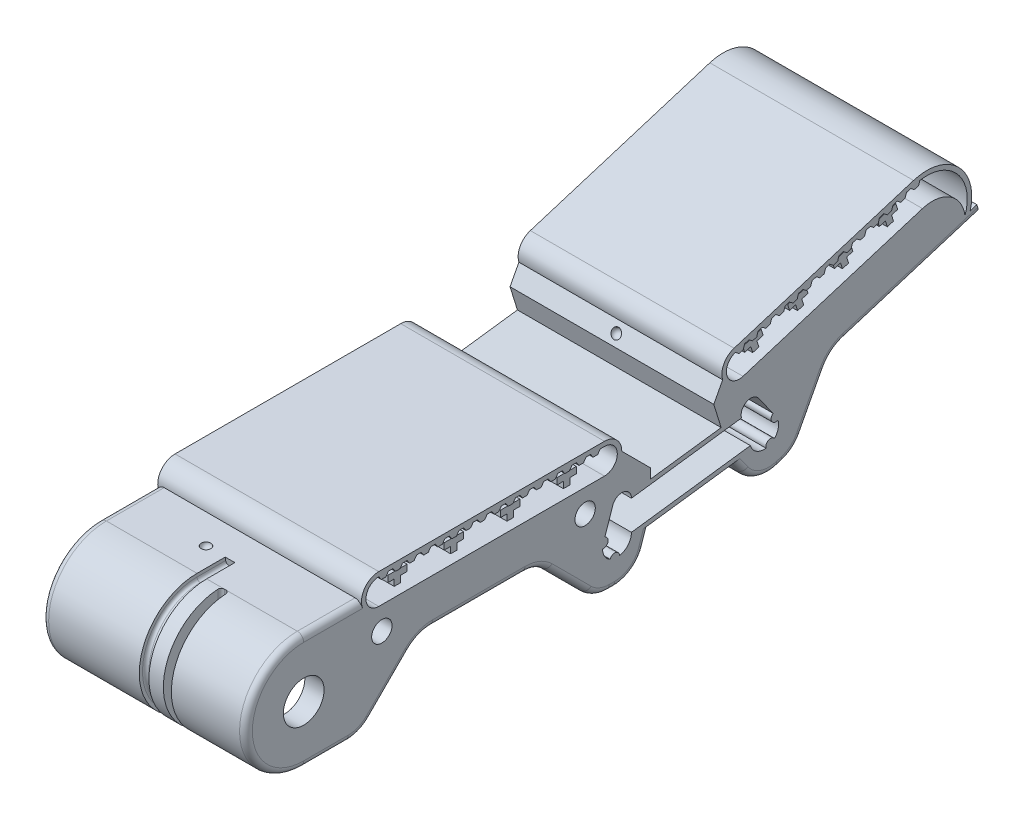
SolidWorks part; units mm, degrees
ref_plane "Front Plane" through (0, 0, 0) normal (0, 0, 1) x (1, 0, 0)
ref_plane "Top Plane" through (0, 0, 0) normal (0, 1, 0) x (1, 0, 0)
ref_plane "Right Plane" through (0, 0, 0) normal (1, 0, 0) x (0, 0, -1)
sketch "Sketch1" plane through (0, 0, 0) normal (1, 0, 0) x (0, 0, -1)
  line L0 (0, 0) -> (54.0462, 0) construction
  line L1 (54.0462, 0) -> (65.9436, 1.5663) construction
  line L2 (65.9436, 1.5663) -> (98.4935, 11.6394) construction
  line L3 (0, 0) -> (59.9949, 0.7832) construction
  line L4 (59.9949, 0.7832) -> (98.4935, 11.6394) construction
  line L5 (0, 3.175) -> (0, -3.175) construction
  line L6 (0, 9) -> (54.0462, 9)
  line L7 (0, -9) -> (54.0462, -9)
  line L8 (54.0462, 9) -> (54.0462, -9) construction
  line L9 (63.2829, 10.164) -> (95.8328, 20.2371)
  line L10 (68.6042, -7.0314) -> (101.1542, 3.0416)
  line L11 (101.1542, 3.0416) -> (95.8328, 20.2371)
  line L12 (63.2829, 10.164) -> (68.6042, -7.0314) construction
  line L13 (54.0462, 9) -> (54.0462, 3.0058)
  line L14 (54.0462, 3.0058) -> (65.0498, 4.4545)
  line L15 (65.0498, 4.4545) -> (63.2829, 10.164)
  line L16 (54.0462, -9) -> (54.0462, -3.0058)
  line L17 (54.0462, -3.0058) -> (66.8373, -1.3218)
  line L18 (66.8373, -1.3218) -> (68.6042, -7.0314)
  line L19 (54.0462, 9) -> (63.2829, 10.164) construction
  line L20 (54.0462, -9) -> (68.6042, -7.0314) construction
  circle A0 centre (0, 0) radius 3.175
  arc A1 (0, 9) -> (0, -9) centre (0, 0) ccw
  dimension "D6" = 6.35
  dimension "D7" = 18
  dimension "D1" = 15
  dimension "D2" = 7.5
  dimension "D3" = 60
  dimension "D4" = 40
  dimension "D5" = 12
  dimension "D8" = 18
  dimension "D9" = 5.9602
extrude "Base" add sketch "Sketch1" along normal mid plane 31.75
sketch "Sketch2" plane through (15.875, 0, 0) normal (1, 0, 0) x (0, 0, -1)
  line L0 (59.548, 3.7301) -> (60.4418, -2.1638) construction
  line L1 (65.0498, 4.4545) -> (54.0462, 3.0058) construction
  line L2 (54.0462, -3.0058) -> (66.8373, -1.3218) construction
  line L3 (54.0462, 3.0058) -> (54.0462, -3.0058) construction
  line L4 (65.0498, 4.4545) -> (66.8373, -1.3218) construction
  line L5 (54.0462, 0) -> (65.9436, 1.5663) construction
  line L6 (54.0462, 2.2998) -> (65.2597, 3.7761)
  line L7 (54.0462, -2.2998) -> (66.6274, -0.6434)
  line L8 (54.0462, 2.2998) -> (51.0719, 1.9082)
  line L9 (54.0462, -2.2998) -> (51.0719, -2.6914)
  line L10 (48.1496, 2.3847) -> (46.6884, -1.9766)
  line L11 (51.0719, 1.9082) -> (51.0719, -2.6914) construction
  line L12 (65.2597, 3.7761) -> (68.2341, 4.1676)
  line L13 (66.6274, -0.6434) -> (69.6017, -0.2519)
  line L14 (70.8865, 5.4845) -> (73.5804, 1.7235)
  line L15 (68.2341, 4.1676) -> (69.6017, -0.2519) construction
  arc A0 (51.0719, 1.9082) -> (48.1496, 2.3847) centre (49.5719, 1.9082) ccw
  arc A1 (51.0719, -2.6914) -> (46.6884, -1.9766) centre (48.8219, -2.6914) cw
  arc A2 (68.2341, 4.1676) -> (70.8865, 5.4845) centre (69.667, 4.6111) cw
  arc A3 (69.6017, -0.2519) -> (73.5804, 1.7235) centre (71.7512, 0.4133) ccw
  point P14 (59.9949, 0.7832)
  dimension "D3" = 1.5
  dimension "D4" = 2.25
  dimension "D1" = 0.7
  dimension "D2" = 3
extrude "Flexure" cut sketch "Sketch2" against normal through all
sketch "Sketch3" plane through (15.875, 0, 0) normal (1, 0, 0) x (0, 0, -1)
  line L0 (46.6884, -1.9766) -> (51.0719, -2.6914) construction
  line L1 (69.6017, -0.2519) -> (73.5804, 1.7235) construction
  line L2 (48.8802, -2.334) -> (48.4598, -4.912) construction
  line L3 (71.591, 0.7358) -> (72.7517, -1.602) construction
  arc A0 (46.6884, -1.9766) -> (51.0719, -2.6914) centre (48.8219, -2.6914) ccw construction
  arc A1 (69.6017, -0.2519) -> (73.5804, 1.7235) centre (71.7512, 0.4133) ccw construction
  circle A2 centre (46.6884, -1.9766) radius 0.75
  circle A3 centre (48.4598, -4.912) radius 0.75
  circle A4 centre (72.7517, -1.602) radius 0.75
  circle A5 centre (73.5804, 1.7235) radius 0.75
  dimension "D1" = 1.5
extrude "Flexure Anchors" add sketch "Sketch3" against normal up to surface (31.75 mm away)
sketch "Sketch4" plane through (15.875, 0, 0) normal (1, 0, 0) x (0, 0, -1)
  line L0 (27.0231, -9) -> (27.0231, 9) construction
  line L1 (0, -9) -> (54.0462, -9) construction
  line L2 (54.0462, 9) -> (0, 9) construction
  line L3 (-8.3297, 3.4082) -> (54.0462, 3.4082) construction
  line L4 (54.0462, 3.0058) -> (54.0462, 9) construction
  line L5 (48.1496, 2.3847) -> (46.9267, -1.2655) construction
  line L6 (44.9746, 2.2857) -> (51.689, 9) construction
  line L7 (49.5676, 9) -> (54.0462, 4.5214)
  line L8 (54.0462, 4.5214) -> (54.0462, 9)
  line L9 (54.0462, 9) -> (49.5676, 9)
  line L10 (63.2829, 10.164) -> (63.902, 8.1634)
  line L11 (63.2829, 10.164) -> (65.0498, 4.4545) construction
  line L12 (63.902, 8.1634) -> (65.2835, 10.7831)
  line L13 (95.8328, 20.2371) -> (63.2829, 10.164) construction
  line L14 (65.2835, 10.7831) -> (63.2829, 10.164)
  line L15 (59.653, 3.0379) -> (60.3368, -1.4716) construction
  line L16 (68.2341, 4.1676) -> (51.0719, 1.9082) construction
  line L17 (51.0719, -2.6914) -> (69.6017, -0.2519) construction
  line L18 (59.9949, 0.7832) -> (73.0252, 2.4986) construction
  line L19 (73.1436, 2.3332) -> (70.8865, 5.4845) construction
  arc A0 (0, 9) -> (0, -9) centre (0, 0) ccw construction
  arc A1 (51.0719, 1.9082) -> (48.1496, 2.3847) centre (49.5719, 1.9082) ccw construction
  circle A2 centre (43.8521, 3.4082) radius 1.5875
  circle A3 centre (12.175, 3.4082) radius 1.5875
  circle A6 centre (0, 0) radius 3.175 construction
  point P38 (64.5838, 9.4563)
  dimension "D1" = 3.175
  dimension "D2" = 4.4
  dimension "D5" = 12.175
  dimension "D3" = 45
  dimension "D4" = 1.5
  dimension "D6" = 1.5
  dimension "D7" = 8
extrude "Pin Holes" cut sketch "Sketch4" against normal through all
sketch "Sketch5" plane through (0, 29.2838, -29.2838) normal (0, 0.7071, -0.7071) x (1, 0, 0)
  line L0 (0, 28.6857) -> (0, 35.0193) construction
  line L1 (-15.875, 28.6857) -> (15.875, 28.6857) construction
  line L2 (-15.875, 35.0193) -> (15.875, 35.0193) construction
  circle A0 centre (0, 30.1857) radius 0.75
  dimension "D1" = 1.5
  dimension "D2" = 1.5
extrude "Tendon Route 1" cut sketch "Sketch5" against normal blind 0.75
sketch "Sketch6" plane through (0, -24.5899, -46.6298) normal (0, 0.4665, 0.8845) x (1, 0, 0)
  line L0 (0, 39.9901) -> (0, 37.0285) construction
  line L1 (-15.875, 39.9901) -> (15.875, 39.9901) construction
  line L2 (-15.875, 37.0285) -> (15.875, 37.0285) construction
  circle A0 centre (0, 38.4901) radius 0.75
  dimension "D1" = 1.5
  dimension "D2" = 1.5
extrude "Tendon Route 2" cut sketch "Sketch6" against normal blind 0.75
sketch "Sketch10" plane through (15.875, 0, 0) normal (1, 0, 0) x (0, 0, -1)
  line L0 (11.7, 11.7) -> (46.8676, 11.7)
  line L1 (49.5676, 9) -> (0, 9) construction
  line L2 (9, 9) -> (49.5676, 9)
  line L3 (65.2835, 10.7831) -> (95.8328, 20.2371)
  line L4 (67.0646, 14.1607) -> (95.0346, 22.8164)
  line L5 (95.8328, 20.2371) -> (95.0346, 22.8164) construction
  line L6 (101.1542, 3.0416) -> (95.8328, 20.2371) construction
  line L7 (95.8328, 20.2371) -> (99.1735, 9.4422)
  arc A0 (46.8676, 11.7) -> (49.5676, 9) centre (46.8676, 9) cw
  arc A1 (11.7, 11.7) -> (9, 9) centre (11.7, 9) ccw
  arc A2 (65.2835, 10.7831) -> (67.0646, 14.1607) centre (67.8628, 11.5813) cw
  arc A3 (95.0346, 22.8164) -> (99.1735, 9.4422) centre (97.104, 16.1293) cw
  dimension "D3" = 7
  dimension "D1" = 2.7
  dimension "D2" = 9
extrude "Finger Pad Outline" add sketch "Sketch10" against normal up to surface (31.75 mm away)
sketch "Sketch11" plane through (15.875, 0, 0) normal (1, 0, 0) x (0, 0, -1)
  line L0 (82.3108, 6.1025) -> (103.114, 12.5404)
  line L1 (68.6042, -7.0314) -> (101.1542, 3.0416) construction
  line L2 (76.7071, -4.5239) -> (107.8413, 5.1111)
  line L3 (107.8413, 5.1111) -> (103.7911, 18.1987)
  line L4 (68.2341, 4.1676) -> (69.6017, -0.2519) construction
  line L5 (68.9179, 1.9579) -> (103.114, 12.5404) construction
  line L6 (82.3108, 6.1025) -> (76.7071, -4.5239)
  line L7 (63.902, 8.1634) -> (65.2835, 10.7831) construction
  line L8 (66.8373, -1.3218) -> (68.6042, -7.0314)
  line L9 (68.6042, -7.0314) -> (70.5054, -6.4431)
  line L10 (70.5054, -6.4431) -> (66.8373, -1.3218)
  line L11 (73.1436, 2.3332) -> (70.8865, 5.4845) construction
  line L12 (70.5054, -6.4431) -> (76.7071, -4.5239) construction
  line L13 (54.0462, -3.0058) -> (52.038, -9)
  line L14 (0, -9) -> (54.0462, -9) construction
  line L15 (52.038, -9) -> (54.0462, -9)
  line L16 (54.0462, -9) -> (54.0462, -3.0058)
  line L17 (48.1496, 2.3847) -> (46.9267, -1.2655) construction
  line L18 (9, 9) -> (9, -9) construction
  line L19 (0, 0) -> (47.3506, 0) construction
  line L20 (9, -9) -> (18, 0)
  line L21 (18, 0) -> (36.5462, 0)
  line L22 (36.5462, 0) -> (45.5462, -9)
  line L23 (45.5462, -9) -> (52.038, -9)
  line L24 (49.5676, 9) -> (54.0462, 4.5214) construction
  line L25 (51.0719, 1.9082) -> (51.0719, -2.6914) construction
  line L26 (9, -9) -> (45.5462, -9)
  arc A0 (99.1735, 9.4422) -> (95.0346, 22.8164) centre (97.104, 16.1293) ccw construction
  arc A1 (103.114, 12.5404) -> (103.7911, 18.1987) centre (97.104, 16.1293) ccw
  dimension "D1" = 8.5
extrude "Finger Outline" cut sketch "Sketch11" against normal through all
sketch "Sketch12" plane through (15.875, 0, 0) normal (1, 0, 0) x (0, 0, -1)
  line L0 (9, 9) -> (49.5676, 9) construction
  line L1 (65.2835, 10.7831) -> (101.1095, 21.87) construction
  line L2 (95.0346, 22.8164) -> (67.0646, 14.1607) construction
  line L3 (11.7, 11.7) -> (11.7, 6.3) construction
  line L4 (11.7, 11) -> (46.8676, 11)
  line L5 (46.8676, 11.7) -> (46.8676, 6.3) construction
  line L6 (46.8676, 11.7) -> (11.7, 11.7) construction
  line L7 (11.7, 7) -> (46.8676, 7)
  line L8 (67.0646, 14.1607) -> (68.8973, 8.2385) construction
  line L9 (67.2715, 13.492) -> (95.2416, 22.1477)
  line L10 (68.454, 9.6707) -> (96.4241, 18.3265)
  line L11 (95.0346, 22.8164) -> (97.7804, 13.9436) construction
  arc A0 (103.114, 12.5404) -> (95.0346, 22.8164) centre (97.104, 16.1293) ccw construction
  arc A1 (11.7, 11) -> (11.7, 7) centre (11.7, 9) ccw
  arc A2 (46.8676, 11) -> (46.8676, 7) centre (46.8676, 9) cw
  arc A3 (67.2715, 13.492) -> (68.454, 9.6707) centre (67.8628, 11.5813) ccw
  arc A4 (95.2416, 22.1477) -> (103.0476, 14.0404) centre (97.104, 16.1293) cw
  arc A5 (96.4241, 18.3265) -> (103.0476, 14.0404) centre (97.9441, 13.4146) cw
  dimension "D1" = 0.7
  dimension "D2" = 0.7
  dimension "D3" = 1.5
extrude "Finger Pad Cavity" cut sketch "Sketch12" against normal through all
sketch "Sketch15" plane through (0, 0, 0) normal (1, 0, 0) x (0, 0, -1)
  line L0 (11.7, 7) -> (46.8676, 7) construction
  line L1 (11.7, 7) -> (46.8676, 7) construction
  line L2 (46.8676, 11) -> (11.7, 11) construction
  line L3 (46.8676, 11) -> (11.7, 11) construction
  line L4 (29.2838, 11) -> (29.2838, 7) construction
  line L5 (11.7, 8) -> (20.4919, 8) construction
  line L6 (16.096, 7) -> (16.096, 8) construction
  line L7 (11.7, 11) -> (11.7, 7) construction
  line L8 (25.3879, 8) -> (25.3879, 7)
  line L9 (26.3879, 8) -> (25.3879, 8)
  line L10 (11.7, 9) -> (29.2838, 9) construction
  line L11 (20.4919, 9) -> (20.4919, 7) construction
  line L12 (15.596, 7) -> (16.596, 7)
  line L13 (16.596, 7) -> (16.596, 8)
  line L14 (16.596, 8) -> (17.596, 8)
  line L15 (17.596, 8) -> (17.596, 9)
  line L16 (17.596, 9) -> (14.596, 9)
  line L17 (14.596, 9) -> (14.596, 8)
  line L18 (14.596, 8) -> (15.596, 8)
  line L19 (15.596, 8) -> (15.596, 7)
  line L20 (26.3879, 9) -> (26.3879, 8)
  line L21 (23.3879, 9) -> (26.3879, 9)
  line L22 (23.3879, 8) -> (23.3879, 9)
  line L23 (24.3879, 8) -> (23.3879, 8)
  line L24 (24.3879, 7) -> (24.3879, 8)
  line L25 (25.3879, 7) -> (24.3879, 7)
  line L26 (33.1798, 7) -> (34.1798, 7)
  line L27 (34.1798, 7) -> (34.1798, 8)
  line L28 (34.1798, 8) -> (35.1798, 8)
  line L29 (35.1798, 8) -> (35.1798, 9)
  line L30 (35.1798, 9) -> (32.1798, 9)
  line L31 (32.1798, 9) -> (32.1798, 8)
  line L32 (32.1798, 8) -> (33.1798, 8)
  line L33 (33.1798, 8) -> (33.1798, 7)
  line L34 (42.9717, 8) -> (42.9717, 7)
  line L35 (43.9717, 8) -> (42.9717, 8)
  line L36 (43.9717, 9) -> (43.9717, 8)
  line L37 (40.9717, 9) -> (43.9717, 9)
  line L38 (40.9717, 8) -> (40.9717, 9)
  line L39 (41.9717, 8) -> (40.9717, 8)
  line L40 (41.9717, 7) -> (41.9717, 8)
  line L41 (42.9717, 7) -> (41.9717, 7)
  line L42 (68.454, 9.6707) -> (96.4241, 18.3265) construction
  line L43 (95.2416, 22.1477) -> (67.2715, 13.492) construction
  line L44 (68.454, 9.6707) -> (96.4241, 18.3265) construction
  line L45 (95.2416, 22.1477) -> (67.2715, 13.492) construction
  line L46 (67.2715, 13.492) -> (68.454, 9.6707) construction
  line L47 (81.2565, 17.8198) -> (82.4391, 13.9986) construction
  line L48 (67.8628, 11.5813) -> (81.8478, 15.9092) construction
  line L49 (74.8553, 13.7453) -> (75.4466, 11.8347) construction
  line L50 (69.9261, 12.2199) -> (70.2217, 11.2646)
  line L51 (70.2217, 11.2646) -> (71.177, 11.5602)
  line L52 (71.177, 11.5602) -> (71.4726, 10.6049)
  line L53 (71.4726, 10.6049) -> (72.4279, 10.9005)
  line L54 (72.4279, 10.9005) -> (72.1323, 11.8558)
  line L55 (72.1323, 11.8558) -> (73.0876, 12.1515)
  line L56 (73.0876, 12.1515) -> (72.792, 13.1068)
  line L57 (72.792, 13.1068) -> (69.9261, 12.2199)
  line L58 (68.1584, 10.626) -> (75.1509, 12.79) construction
  line L59 (71.9503, 10.7527) -> (71.6547, 11.708) construction
  line L60 (76.9186, 14.3838) -> (79.7845, 15.2707)
  line L61 (77.2142, 13.4285) -> (76.9186, 14.3838)
  line L62 (78.1695, 13.7241) -> (77.2142, 13.4285)
  line L63 (78.4652, 12.7688) -> (78.1695, 13.7241)
  line L64 (79.4205, 13.0645) -> (78.4652, 12.7688)
  line L65 (79.1248, 14.0198) -> (79.4205, 13.0645)
  line L66 (80.0801, 14.3154) -> (79.1248, 14.0198)
  line L67 (79.7845, 15.2707) -> (80.0801, 14.3154)
  line L68 (90.9036, 18.7117) -> (93.7695, 19.5986)
  line L69 (91.1992, 17.7564) -> (90.9036, 18.7117)
  line L70 (92.1545, 18.052) -> (91.1992, 17.7564)
  line L71 (92.4502, 17.0967) -> (92.1545, 18.052)
  line L72 (93.4055, 17.3923) -> (92.4502, 17.0967)
  line L73 (93.1098, 18.3476) -> (93.4055, 17.3923)
  line L74 (94.0651, 18.6432) -> (93.1098, 18.3476)
  line L75 (93.7695, 19.5986) -> (94.0651, 18.6432)
  line L76 (83.9111, 16.5477) -> (84.2067, 15.5924)
  line L77 (84.2067, 15.5924) -> (85.162, 15.8881)
  line L78 (85.162, 15.8881) -> (85.4577, 14.9328)
  line L79 (85.4577, 14.9328) -> (86.413, 15.2284)
  line L80 (86.413, 15.2284) -> (86.1173, 16.1837)
  line L81 (86.1173, 16.1837) -> (87.0726, 16.4793)
  line L82 (87.0726, 16.4793) -> (86.777, 17.4346)
  line L83 (86.777, 17.4346) -> (83.9111, 16.5477)
extrude "Finger Pad Hooks" add sketch "Sketch15" along normal mid plane 28.75
sketch "Sketch16" plane through (15.875, 0, 0) normal (1, 0, 0) x (0, 0, -1)
  line L0 (11.7, 11.7) -> (11.7, 11) construction
  line L1 (11.7, 11) -> (12.1, 10.4255)
  line L2 (12.1, 10.4255) -> (12.8, 10.4255)
  line L3 (12.8, 10.4255) -> (13.2, 11)
  line L4 (46.8676, 11) -> (11.7, 11) construction
  line L5 (13.2, 11) -> (11.7, 11)
  line L6 (13.9, 11) -> (14.3, 10.4255)
  line L7 (14.3, 10.4255) -> (15, 10.4255)
  line L8 (15, 10.4255) -> (15.4, 11)
  line L9 (15.4, 11) -> (13.9, 11)
  line L10 (16.1, 11) -> (16.5, 10.4255)
  line L11 (16.5, 10.4255) -> (17.2, 10.4255)
  line L12 (17.2, 10.4255) -> (17.6, 11)
  line L13 (17.6, 11) -> (16.1, 11)
  line L14 (18.3, 11) -> (18.7, 10.4255)
  line L15 (18.7, 10.4255) -> (19.4, 10.4255)
  line L16 (19.4, 10.4255) -> (19.8, 11)
  line L17 (19.8, 11) -> (18.3, 11)
  line L18 (20.5, 11) -> (20.9, 10.4255)
  line L19 (20.9, 10.4255) -> (21.6, 10.4255)
  line L20 (21.6, 10.4255) -> (22, 11)
  line L21 (22, 11) -> (20.5, 11)
  line L22 (22.7, 11) -> (23.1, 10.4255)
  line L23 (23.1, 10.4255) -> (23.8, 10.4255)
  line L24 (23.8, 10.4255) -> (24.2, 11)
  line L25 (24.2, 11) -> (22.7, 11)
  line L26 (24.9, 11) -> (25.3, 10.4255)
  line L27 (25.3, 10.4255) -> (26, 10.4255)
  line L28 (26, 10.4255) -> (26.4, 11)
  line L29 (26.4, 11) -> (24.9, 11)
  line L30 (27.1, 11) -> (27.5, 10.4255)
  line L31 (27.5, 10.4255) -> (28.2, 10.4255)
  line L32 (28.2, 10.4255) -> (28.6, 11)
  line L33 (28.6, 11) -> (27.1, 11)
  line L34 (29.3, 11) -> (29.7, 10.4255)
  line L35 (29.7, 10.4255) -> (30.4, 10.4255)
  line L36 (30.4, 10.4255) -> (30.8, 11)
  line L37 (30.8, 11) -> (29.3, 11)
  line L38 (31.5, 11) -> (31.9, 10.4255)
  line L39 (31.9, 10.4255) -> (32.6, 10.4255)
  line L40 (32.6, 10.4255) -> (33, 11)
  line L41 (33, 11) -> (31.5, 11)
  line L42 (33.7, 11) -> (34.1, 10.4255)
  line L43 (34.1, 10.4255) -> (34.8, 10.4255)
  line L44 (34.8, 10.4255) -> (35.2, 11)
  line L45 (35.2, 11) -> (33.7, 11)
  line L46 (35.9, 11) -> (36.3, 10.4255)
  line L47 (36.3, 10.4255) -> (37, 10.4255)
  line L48 (37, 10.4255) -> (37.4, 11)
  line L49 (37.4, 11) -> (35.9, 11)
  line L50 (38.1, 11) -> (38.5, 10.4255)
  line L51 (38.5, 10.4255) -> (39.2, 10.4255)
  line L52 (39.2, 10.4255) -> (39.6, 11)
  line L53 (39.6, 11) -> (38.1, 11)
  line L54 (40.3, 11) -> (40.7, 10.4255)
  line L55 (40.7, 10.4255) -> (41.4, 10.4255)
  line L56 (41.4, 10.4255) -> (41.8, 11)
  line L57 (41.8, 11) -> (40.3, 11)
  line L58 (42.5, 11) -> (42.9, 10.4255)
  line L59 (42.9, 10.4255) -> (43.6, 10.4255)
  line L60 (43.6, 10.4255) -> (44, 11)
  line L61 (44, 11) -> (42.5, 11)
  line L62 (44.7, 11) -> (45.1, 10.4255)
  line L63 (45.1, 10.4255) -> (45.8, 10.4255)
  line L64 (45.8, 10.4255) -> (46.2, 11)
  line L65 (46.2, 11) -> (44.7, 11)
  line L66 (67.0646, 14.1607) -> (67.2715, 13.492) construction
  line L67 (67.2715, 13.492) -> (67.8235, 13.0614)
  line L68 (67.8235, 13.0614) -> (68.4922, 13.2684)
  line L69 (68.4922, 13.2684) -> (68.7045, 13.9354)
  line L70 (95.2416, 22.1477) -> (67.2715, 13.492) construction
  line L71 (68.7045, 13.9354) -> (67.2715, 13.492)
  line L72 (69.3732, 14.1423) -> (69.9251, 13.7118)
  line L73 (69.9251, 13.7118) -> (70.5938, 13.9188)
  line L74 (70.5938, 13.9188) -> (70.8061, 14.5858)
  line L75 (70.8061, 14.5858) -> (69.3732, 14.1423)
  line L76 (69.1662, 14.8111) -> (69.3732, 14.1423) construction
  line L77 (71.4748, 14.7927) -> (72.0268, 14.3622)
  line L78 (72.0268, 14.3622) -> (72.6955, 14.5691)
  line L79 (72.6955, 14.5691) -> (72.9078, 15.2362)
  line L80 (72.9078, 15.2362) -> (71.4748, 14.7927)
  line L81 (71.2679, 15.4614) -> (71.4748, 14.7927) construction
  line L82 (73.5765, 15.4431) -> (74.1285, 15.0126)
  line L83 (74.1285, 15.0126) -> (74.7972, 15.2195)
  line L84 (74.7972, 15.2195) -> (75.0095, 15.8866)
  line L85 (75.0095, 15.8866) -> (73.5765, 15.4431)
  line L86 (73.3696, 16.1118) -> (73.5765, 15.4431) construction
  line L87 (75.6782, 16.0935) -> (76.2301, 15.663)
  line L88 (76.2301, 15.663) -> (76.8988, 15.8699)
  line L89 (76.8988, 15.8699) -> (77.1111, 16.537)
  line L90 (77.1111, 16.537) -> (75.6782, 16.0935)
  line L91 (75.4712, 16.7622) -> (75.6782, 16.0935) construction
  line L92 (77.7798, 16.7439) -> (78.3318, 16.3134)
  line L93 (78.3318, 16.3134) -> (79.0005, 16.5203)
  line L94 (79.0005, 16.5203) -> (79.2128, 17.1873)
  line L95 (79.2128, 17.1873) -> (77.7798, 16.7439)
  line L96 (77.5729, 17.4126) -> (77.7798, 16.7439) construction
  line L97 (79.8815, 17.3943) -> (80.4334, 16.9638)
  line L98 (80.4334, 16.9638) -> (81.1022, 17.1707)
  line L99 (81.1022, 17.1707) -> (81.3145, 17.8377)
  line L100 (81.3145, 17.8377) -> (79.8815, 17.3943)
  line L101 (79.6746, 18.063) -> (79.8815, 17.3943) construction
  line L102 (81.9832, 18.0447) -> (82.5351, 17.6142)
  line L103 (82.5351, 17.6142) -> (83.2038, 17.8211)
  line L104 (83.2038, 17.8211) -> (83.4161, 18.4881)
  line L105 (83.4161, 18.4881) -> (81.9832, 18.0447)
  line L106 (81.7762, 18.7134) -> (81.9832, 18.0447) construction
  line L107 (84.0848, 18.6951) -> (84.6368, 18.2645)
  line L108 (84.6368, 18.2645) -> (85.3055, 18.4715)
  line L109 (85.3055, 18.4715) -> (85.5178, 19.1385)
  line L110 (85.5178, 19.1385) -> (84.0848, 18.6951)
  line L111 (83.8779, 19.3638) -> (84.0848, 18.6951) construction
  line L112 (86.1865, 19.3455) -> (86.7384, 18.9149)
  line L113 (86.7384, 18.9149) -> (87.4072, 19.1219)
  line L114 (87.4072, 19.1219) -> (87.6194, 19.7889)
  line L115 (87.6194, 19.7889) -> (86.1865, 19.3455)
  line L116 (85.9796, 20.0142) -> (86.1865, 19.3455) construction
  line L117 (88.2882, 19.9958) -> (88.8401, 19.5653)
  line L118 (88.8401, 19.5653) -> (89.5088, 19.7723)
  line L119 (89.5088, 19.7723) -> (89.7211, 20.4393)
  line L120 (89.7211, 20.4393) -> (88.2882, 19.9958)
  line L121 (88.0812, 20.6646) -> (88.2882, 19.9958) construction
  line L122 (90.3898, 20.6462) -> (90.9418, 20.2157)
  line L123 (90.9418, 20.2157) -> (91.6105, 20.4227)
  line L124 (91.6105, 20.4227) -> (91.8228, 21.0897)
  line L125 (91.8228, 21.0897) -> (90.3898, 20.6462)
  line L126 (90.1829, 21.3149) -> (90.3898, 20.6462) construction
  line L127 (92.4915, 21.2966) -> (93.0434, 20.8661)
  line L128 (93.0434, 20.8661) -> (93.7121, 21.073)
  line L129 (93.7121, 21.073) -> (93.9244, 21.7401)
  line L130 (93.9244, 21.7401) -> (92.4915, 21.2966)
  line L131 (92.2845, 21.9653) -> (92.4915, 21.2966) construction
  line L132 (94.5932, 21.947) -> (95.1451, 21.5165)
  line L133 (95.1451, 21.5165) -> (95.8138, 21.7234)
  line L134 (95.8138, 21.7234) -> (96.0261, 22.3905)
  line L135 (96.0261, 22.3905) -> (94.5932, 21.947)
  line L136 (94.3862, 22.6157) -> (94.5932, 21.947) construction
  dimension "D1" = 1.5
  dimension "D2" = 0.7
  dimension "D3" = 16
  dimension "D4" = 14
extrude "Ridges" add sketch "Sketch16" against normal up to surface (31.75 mm away)
sketch "Sketch20" plane through (0, 0, 0) normal (1, 0, 0) x (0, 0, -1)
  line L0 (0, 5) -> (10.5322, 5)
  line L1 (0, -9) -> (0, -5)
  line L2 (0, -9) -> (41.7702, -9)
  line L3 (43.8521, 3.4082) -> (74.9103, 7.4971) construction
  line L4 (12.175, 5.6957) -> (43.8521, 5.6957)
  line L5 (41.7702, -9) -> (46.0017, 2.6258)
  line L6 (68.454, 9.6707) -> (96.4241, 18.3265) construction
  line L7 (41.7702, -9) -> (52.038, -9) construction
  line L8 (80.3143, -3.4076) -> (70.5054, -6.4431) construction
  line L9 (80.3143, -3.4076) -> (106.1271, 4.5806)
  line L10 (70.5054, -6.4431) -> (76.7071, -4.5239) construction
  line L11 (80.3143, -3.4076) -> (73.0881, 6.1142)
  line L12 (68.454, 9.6707) -> (96.4241, 18.3265) construction
  line L13 (65.0498, 4.4545) -> (54.0462, 3.0058) construction
  line L14 (96.4241, 18.3265) -> (102.5983, -1.6248) construction
  line L15 (96.926, 16.7047) -> (74.234, 9.6823)
  line L16 (96.926, 16.7047) -> (106.1271, 4.5806)
  circle A0 centre (0, 0) radius 9 construction
  circle A1 centre (12.175, 3.4082) radius 2.2875 construction
  circle A2 centre (43.8521, 3.4082) radius 2.2875 construction
  arc A3 (12.175, 5.6957) -> (10.5322, 5) centre (12.175, 3.4082) ccw
  arc A4 (0, 9) -> (0, -9) centre (0, 0) ccw construction
  circle A5 centre (0, 0) radius 5 construction
  arc A6 (0, 5) -> (0, -5) centre (0, 0) ccw
  arc A7 (43.8521, 5.6957) -> (46.0017, 2.6258) centre (43.8521, 3.4082) cw
  circle A8 centre (12.175, 3.4082) radius 1.5875 construction
  arc A9 (74.234, 9.6823) -> (73.0881, 6.1142) centre (74.9103, 7.4971) ccw
  dimension "D1" = 0.7
  dimension "D2" = 10
  dimension "D4" = 70
  dimension "D5" = 70
extrude "Finger Back Cutaway" cut sketch "Sketch20" against normal mid plane 25.75
sketch "Sketch21" plane through (0, 0, 0) normal (1, 0, 0) x (0, 0, -1)
  line L0 (0, 9) -> (11.7, 9) construction
  line L1 (11.1287, 2.2143) -> (3.3855, 9) construction
  line L2 (0, 9) -> (0, -9) construction
  line L3 (0, 0) -> (0, -9) construction
  line L4 (0, 8) -> (4.5266, 8)
  line L5 (3.3855, 10.7356) -> (3.3855, 6.5349) construction
  line L6 (0, -8) -> (0, -9)
  line L7 (4.5266, 8) -> (4.3943, 9)
  line L8 (4.3943, 9) -> (0, 9)
  circle A0 centre (12.175, 3.4082) radius 1.5875 construction
  circle A1 centre (12.175, 3.4082) radius 1.5875 construction
  circle A2 centre (0, 0) radius 9 construction
  arc A3 (0, 9) -> (0, -9) centre (0, 0) ccw construction
  arc A4 (0, 9) -> (0, -9) centre (0, 0) ccw
  arc A5 (0, 8) -> (0, -8) centre (0, 0) ccw
  dimension "D1" = 8
extrude "Tendon Track" cut sketch "Sketch21" against normal mid plane 1.5
sketch "Sketch22" plane through (0, 0, 0) normal (0, 0, -1) x (-1, 0, 0)
  line L0 (-0.75, -9) -> (-12.875, -9) construction
  line L1 (-4.25, 9) -> (-3, 9)
  line L2 (-4.25, 9) -> (-4.25, -9)
  line L3 (-4.25, -9) -> (-3, -9)
  line L4 (-3, 9) -> (-3, -9)
  line L5 (-15.875, 9) -> (-0.75, 9) construction
  line L6 (0, -8) -> (0, 0) construction
  line L7 (0.75, -8) -> (-0.75, -8) construction
  dimension "D1" = 1.25
  dimension "D2" = 3
extrude "Torsion Spring Clearance" cut sketch "Sketch22" against normal through all
sketch "Sketch24" plane through (0, 9, 0) normal (0, 1, 0) x (1, 0, 0)
  line L0 (-15.875, 4.3943) -> (15.875, 4.3943) construction
  line L1 (-15.875, 9) -> (-15.875, 0) construction
  line L2 (15.875, 9) -> (15.875, 0) construction
  line L3 (-0.75, 4.3943) -> (0.75, 4.3943) construction
  line L4 (-3, 4.3943) -> (-3, 0) construction
  line L5 (-0.75, 0) -> (-15.875, 0) construction
  line L7 (-15.875, 9) -> (15.875, 9) construction
  line L9 (-3.75, 0) -> (-3.75, 4.3943) construction
  line L10 (0, 0) -> (0, 9) construction
  circle A0 centre (-3.75, 4.3943) radius 0.75
  dimension "D1" = 1.5
  dimension "D2" = 3
extrude "Torsion Spring Route" cut sketch "Sketch24" against normal blind 0.75
fillet "Tendon Route Fillet" radius 0.75 3 edges at (0, 8.4431, -64.8973) (0, 7.9393, -49.5676) (-3.75, 8.25, -3.6443)
fillet "Tendon Track Contouring" radius 0.5 8 edges at (0.75, 0, 8) (0.75, 8, -2.2633) (-0.75, 8, -2.2633) (-0.75, 0, 8) (4.25, 7, 0) (3, 7, 0) (-4.9375, -5, 0) (3, -7, 0)
fillet "Finger Contouring" radius 5 13 edges at (0, -4.5239, -76.7071) (0, -9, -45.5462) (-14.375, 0, -36.5462) (14.375, 0, -36.5462) (14.375, 0, -18) (-14.375, 0, -18) (-14.375, -9, -9) (14.375, -9, -9) (0, -6.4431, -70.5054) (0, -9, -52.038) (0, 16.7047, -96.926) (-14.375, 6.1025, -82.3108) (14.375, 6.1025, -82.3108)
sketch "Sketch25" plane through (15.875, 0, 0) normal (1, 0, 0) x (0, 0, -1)
  line L0 (103.114, 12.5404) -> (105.33, 13.2261)
  line L1 (105.33, 13.2261) -> (104.9005, 14.6138)
  line L2 (104.9005, 14.6138) -> (102.6846, 13.928)
  line L3 (102.6846, 13.928) -> (103.114, 12.5404)
  line L4 (84.2893, 6.7148) -> (103.114, 12.5404) construction
  arc A0 (103.114, 12.5404) -> (95.0346, 22.8164) centre (97.104, 16.1293) ccw construction
extrude "Fingernail" add sketch "Sketch25" against normal up to surface (31.75 mm away)
fillet "Contouring" radius 1 40 edges at (-15.875, -4.2971, -53.6136) (-15.875, -8.0584, -51.3605) (-15.875, -9, -48.0286) (-15.875, -8.6194, -45.7039) (-15.875, -4.5, -41.0462) (-15.875, -0.3806, -36.3886) (-15.875, 0, -27.2731) (-15.875, -0.3806, -18.1577) (-15.875, -4.5, -13.5) (-15.875, -8.6194, -8.8423) (-15.875, -9, -3.4645) (-15.875, 0, 9) (15.875, -4.2971, -53.6136) (15.875, -8.0584, -51.3605) (15.875, -9, -48.0286) (15.875, -8.6194, -45.7039) (15.875, -4.5, -41.0462) (15.875, -0.3806, -36.3886) (15.875, 0, -27.2731) (15.875, -0.3806, -18.1577) (15.875, -4.5, -13.5) (15.875, -8.6194, -8.8423) (15.875, -9, -3.4645) (15.875, 0, 9) (-15.875, 9, -4.5) (15.875, 9, -4.5) (-15.875, -5.2567, -74.3389) (15.875, -5.2567, -74.3389) (-15.875, -4.2069, -76.4439) (-15.875, -5.3397, -70.8767) (-15.875, -2.4171, -67.6218) (-15.875, 0.7893, -79.5089) (15.875, 0.7893, -79.5089) (15.875, -4.2069, -76.4439) (15.875, -5.3397, -70.8767) (15.875, -2.4171, -67.6218) (-15.875, 9.9705, -94.8096) (-15.875, 5.7855, -82.5739) (15.875, 9.9705, -94.8096) (15.875, 5.7855, -82.5739)
sketch "Sketch17" plane through (15.875, 0, 0) normal (1, 0, 0) x (0, 0, -1)
  line L0 (12.1, 10.4255) -> (12.8, 10.4255) construction
  line L1 (12.8, 10.4255) -> (13.2, 11) construction
  line L2 (13.9, 11) -> (13.2, 11) construction
  line L3 (12.1, 10.4255) -> (12.8, 10.4255)
  line L4 (12.8, 10.4255) -> (13.2, 11)
  line L5 (13.9, 11) -> (13.2, 11)
  line L6 (68.2341, 4.1676) -> (51.0719, 1.9082) construction
  line L7 (68.2341, 4.1676) -> (51.0719, 1.9082)
  line L10 (51.0719, -2.6914) -> (69.6017, -0.2519)
  line L11 (48.1496, 2.3847) -> (46.9267, -1.2655)
  line L12 (68.2341, 4.1676) -> (51.0719, 1.9082)
  line L13 (73.1436, 2.3332) -> (70.8865, 5.4845)
  line L14 (51.0719, -2.6914) -> (69.6017, -0.2519)
  line L15 (48.1496, 2.3847) -> (46.9267, -1.2655)
  line L16 (68.2341, 4.1676) -> (51.0719, 1.9082)
  line L17 (73.1436, 2.3332) -> (70.8865, 5.4845)
  line L52 (69.3732, 14.1423) -> (68.7045, 13.9354)
  line L56 (68.454, 9.6707) -> (96.4241, 18.3265)
  line L57 (67.8235, 13.0614) -> (67.2715, 13.492)
  line L58 (68.4922, 13.2684) -> (67.8235, 13.0614)
  line L59 (68.7045, 13.9354) -> (68.4922, 13.2684)
  line L65 (12.1, 10.4255) -> (11.7, 11)
  line L66 (12.8, 10.4255) -> (12.1, 10.4255)
  line L67 (13.2, 11) -> (12.8, 10.4255)
  line L68 (13.9, 11) -> (13.2, 11)
  line L69 (14.3, 10.4255) -> (13.9, 11)
  line L70 (15, 10.4255) -> (14.3, 10.4255)
  line L71 (15.4, 11) -> (15, 10.4255)
  line L72 (16.1, 11) -> (15.4, 11)
  line L73 (16.5, 10.4255) -> (16.1, 11)
  line L74 (17.2, 10.4255) -> (16.5, 10.4255)
  line L75 (17.6, 11) -> (17.2, 10.4255)
  line L76 (18.3, 11) -> (17.6, 11)
  line L77 (18.7, 10.4255) -> (18.3, 11)
  line L78 (19.4, 10.4255) -> (18.7, 10.4255)
  line L79 (19.8, 11) -> (19.4, 10.4255)
  line L80 (20.5, 11) -> (19.8, 11)
  line L81 (20.9, 10.4255) -> (20.5, 11)
  line L82 (21.6, 10.4255) -> (20.9, 10.4255)
  line L83 (22, 11) -> (21.6, 10.4255)
  line L84 (22.7, 11) -> (22, 11)
  line L85 (23.1, 10.4255) -> (22.7, 11)
  line L86 (23.8, 10.4255) -> (23.1, 10.4255)
  line L87 (24.2, 11) -> (23.8, 10.4255)
  line L88 (24.9, 11) -> (24.2, 11)
  line L89 (25.3, 10.4255) -> (24.9, 11)
  line L90 (26, 10.4255) -> (25.3, 10.4255)
  line L91 (26.4, 11) -> (26, 10.4255)
  line L92 (27.1, 11) -> (26.4, 11)
  line L93 (27.5, 10.4255) -> (27.1, 11)
  line L94 (28.2, 10.4255) -> (27.5, 10.4255)
  line L95 (28.6, 11) -> (28.2, 10.4255)
  line L96 (29.3, 11) -> (28.6, 11)
  line L97 (29.7, 10.4255) -> (29.3, 11)
  line L98 (30.4, 10.4255) -> (29.7, 10.4255)
  line L99 (30.8, 11) -> (30.4, 10.4255)
  line L100 (31.5, 11) -> (30.8, 11)
  line L101 (31.9, 10.4255) -> (31.5, 11)
  line L102 (32.6, 10.4255) -> (31.9, 10.4255)
  line L103 (33, 11) -> (32.6, 10.4255)
  line L104 (33.7, 11) -> (33, 11)
  line L105 (34.1, 10.4255) -> (33.7, 11)
  line L106 (34.8, 10.4255) -> (34.1, 10.4255)
  line L107 (35.2, 11) -> (34.8, 10.4255)
  line L108 (35.9, 11) -> (35.2, 11)
  line L109 (36.3, 10.4255) -> (35.9, 11)
  line L110 (37, 10.4255) -> (36.3, 10.4255)
  line L111 (37.4, 11) -> (37, 10.4255)
  line L112 (38.1, 11) -> (37.4, 11)
  line L113 (38.5, 10.4255) -> (38.1, 11)
  line L114 (39.2, 10.4255) -> (38.5, 10.4255)
  line L115 (39.6, 11) -> (39.2, 10.4255)
  line L116 (40.3, 11) -> (39.6, 11)
  line L117 (40.7, 10.4255) -> (40.3, 11)
  line L118 (41.4, 10.4255) -> (40.7, 10.4255)
  line L119 (41.8, 11) -> (41.4, 10.4255)
  line L120 (42.5, 11) -> (41.8, 11)
  line L121 (42.9, 10.4255) -> (42.5, 11)
  line L122 (43.6, 10.4255) -> (42.9, 10.4255)
  line L123 (44, 11) -> (43.6, 10.4255)
  line L129 (11.7, 7) -> (46.8676, 7)
  line L130 (12.1, 10.4255) -> (11.7, 11)
  line L131 (12.8, 10.4255) -> (12.1, 10.4255)
  line L132 (13.2, 11) -> (12.8, 10.4255)
  line L133 (13.9, 11) -> (13.2, 11)
  line L134 (14.3, 10.4255) -> (13.9, 11)
  line L135 (15, 10.4255) -> (14.3, 10.4255)
  line L136 (15.4, 11) -> (15, 10.4255)
  line L137 (16.1, 11) -> (15.4, 11)
  line L138 (16.5, 10.4255) -> (16.1, 11)
  line L139 (17.2, 10.4255) -> (16.5, 10.4255)
  line L140 (17.6, 11) -> (17.2, 10.4255)
  line L141 (18.3, 11) -> (17.6, 11)
  line L142 (18.7, 10.4255) -> (18.3, 11)
  line L143 (19.4, 10.4255) -> (18.7, 10.4255)
  line L144 (19.8, 11) -> (19.4, 10.4255)
  line L145 (20.5, 11) -> (19.8, 11)
  line L146 (20.9, 10.4255) -> (20.5, 11)
  line L147 (21.6, 10.4255) -> (20.9, 10.4255)
  line L148 (22, 11) -> (21.6, 10.4255)
  line L149 (22.7, 11) -> (22, 11)
  line L150 (23.1, 10.4255) -> (22.7, 11)
  line L151 (23.8, 10.4255) -> (23.1, 10.4255)
  line L152 (24.2, 11) -> (23.8, 10.4255)
  line L153 (24.9, 11) -> (24.2, 11)
  line L154 (25.3, 10.4255) -> (24.9, 11)
  line L155 (26, 10.4255) -> (25.3, 10.4255)
  line L156 (26.4, 11) -> (26, 10.4255)
  line L157 (27.1, 11) -> (26.4, 11)
  line L158 (27.5, 10.4255) -> (27.1, 11)
  line L159 (28.2, 10.4255) -> (27.5, 10.4255)
  line L160 (28.6, 11) -> (28.2, 10.4255)
  line L161 (29.3, 11) -> (28.6, 11)
  line L162 (29.7, 10.4255) -> (29.3, 11)
  line L163 (30.4, 10.4255) -> (29.7, 10.4255)
  line L164 (30.8, 11) -> (30.4, 10.4255)
  line L165 (31.5, 11) -> (30.8, 11)
  line L166 (31.9, 10.4255) -> (31.5, 11)
  line L167 (32.6, 10.4255) -> (31.9, 10.4255)
  line L168 (33, 11) -> (32.6, 10.4255)
  line L169 (33.7, 11) -> (33, 11)
  line L170 (34.1, 10.4255) -> (33.7, 11)
  line L171 (34.8, 10.4255) -> (34.1, 10.4255)
  line L172 (35.2, 11) -> (34.8, 10.4255)
  line L173 (35.9, 11) -> (35.2, 11)
  line L174 (36.3, 10.4255) -> (35.9, 11)
  line L175 (37, 10.4255) -> (36.3, 10.4255)
  line L176 (37.4, 11) -> (37, 10.4255)
  line L177 (38.1, 11) -> (37.4, 11)
  line L178 (38.5, 10.4255) -> (38.1, 11)
  line L179 (39.2, 10.4255) -> (38.5, 10.4255)
  line L180 (39.6, 11) -> (39.2, 10.4255)
  line L181 (40.3, 11) -> (39.6, 11)
  line L182 (40.7, 10.4255) -> (40.3, 11)
  line L183 (41.4, 10.4255) -> (40.7, 10.4255)
  line L184 (41.8, 11) -> (41.4, 10.4255)
  line L185 (42.5, 11) -> (41.8, 11)
  line L186 (42.9, 10.4255) -> (42.5, 11)
  line L187 (43.6, 10.4255) -> (42.9, 10.4255)
  line L188 (44, 11) -> (43.6, 10.4255)
  line L194 (11.7, 7) -> (46.8676, 7)
  line L197 (94.5932, 21.947) -> (93.9244, 21.7401)
  line L198 (69.3732, 14.1423) -> (68.7045, 13.9354)
  line L199 (69.9251, 13.7118) -> (69.3732, 14.1423)
  line L200 (69.9251, 13.7118) -> (69.3732, 14.1423)
  line L201 (70.5938, 13.9188) -> (69.9251, 13.7118)
  line L202 (70.5938, 13.9188) -> (69.9251, 13.7118)
  line L203 (70.8061, 14.5858) -> (70.5938, 13.9188)
  line L204 (70.8061, 14.5858) -> (70.5938, 13.9188)
  line L205 (71.4748, 14.7927) -> (70.8061, 14.5858)
  line L206 (71.4748, 14.7927) -> (70.8061, 14.5858)
  line L207 (72.0268, 14.3622) -> (71.4748, 14.7927)
  line L208 (72.0268, 14.3622) -> (71.4748, 14.7927)
  line L209 (72.6955, 14.5691) -> (72.0268, 14.3622)
  line L210 (72.6955, 14.5691) -> (72.0268, 14.3622)
  line L211 (72.9078, 15.2362) -> (72.6955, 14.5691)
  line L212 (72.9078, 15.2362) -> (72.6955, 14.5691)
  line L213 (73.5765, 15.4431) -> (72.9078, 15.2362)
  line L214 (73.5765, 15.4431) -> (72.9078, 15.2362)
  line L215 (74.1285, 15.0126) -> (73.5765, 15.4431)
  line L216 (74.1285, 15.0126) -> (73.5765, 15.4431)
  line L217 (74.7972, 15.2195) -> (74.1285, 15.0126)
  line L218 (74.7972, 15.2195) -> (74.1285, 15.0126)
  line L219 (75.0095, 15.8866) -> (74.7972, 15.2195)
  line L220 (75.0095, 15.8866) -> (74.7972, 15.2195)
  line L221 (75.6782, 16.0935) -> (75.0095, 15.8866)
  line L222 (75.6782, 16.0935) -> (75.0095, 15.8866)
  line L223 (76.2301, 15.663) -> (75.6782, 16.0935)
  line L224 (76.2301, 15.663) -> (75.6782, 16.0935)
  line L225 (76.8988, 15.8699) -> (76.2301, 15.663)
  line L226 (76.8988, 15.8699) -> (76.2301, 15.663)
  line L227 (77.1111, 16.537) -> (76.8988, 15.8699)
  line L228 (77.1111, 16.537) -> (76.8988, 15.8699)
  line L229 (77.7798, 16.7439) -> (77.1111, 16.537)
  line L230 (77.7798, 16.7439) -> (77.1111, 16.537)
  line L231 (78.3318, 16.3134) -> (77.7798, 16.7439)
  line L232 (78.3318, 16.3134) -> (77.7798, 16.7439)
  line L233 (79.0005, 16.5203) -> (78.3318, 16.3134)
  line L234 (79.0005, 16.5203) -> (78.3318, 16.3134)
  line L235 (79.2128, 17.1873) -> (79.0005, 16.5203)
  line L236 (79.2128, 17.1873) -> (79.0005, 16.5203)
  line L237 (79.8815, 17.3943) -> (79.2128, 17.1873)
  line L238 (68.454, 9.6707) -> (96.4241, 18.3265)
  line L239 (67.8235, 13.0614) -> (67.2715, 13.492)
  line L240 (68.4922, 13.2684) -> (67.8235, 13.0614)
  line L241 (68.7045, 13.9354) -> (68.4922, 13.2684)
  line L242 (79.8815, 17.3943) -> (79.2128, 17.1873)
  line L243 (80.4334, 16.9638) -> (79.8815, 17.3943)
  line L244 (80.4334, 16.9638) -> (79.8815, 17.3943)
  line L245 (81.1022, 17.1707) -> (80.4334, 16.9638)
  line L246 (81.1022, 17.1707) -> (80.4334, 16.9638)
  line L247 (81.3145, 17.8377) -> (81.1022, 17.1707)
  line L248 (81.3145, 17.8377) -> (81.1022, 17.1707)
  line L249 (81.9832, 18.0447) -> (81.3145, 17.8377)
  line L250 (81.9832, 18.0447) -> (81.3145, 17.8377)
  line L251 (82.5351, 17.6142) -> (81.9832, 18.0447)
  line L252 (82.5351, 17.6142) -> (81.9832, 18.0447)
  line L253 (83.2038, 17.8211) -> (82.5351, 17.6142)
  line L254 (83.2038, 17.8211) -> (82.5351, 17.6142)
  line L255 (83.4161, 18.4881) -> (83.2038, 17.8211)
  line L256 (83.4161, 18.4881) -> (83.2038, 17.8211)
  line L257 (84.0848, 18.6951) -> (83.4161, 18.4881)
  line L258 (84.0848, 18.6951) -> (83.4161, 18.4881)
  line L259 (84.6368, 18.2645) -> (84.0848, 18.6951)
  line L260 (84.6368, 18.2645) -> (84.0848, 18.6951)
  line L261 (85.3055, 18.4715) -> (84.6368, 18.2645)
  line L262 (85.3055, 18.4715) -> (84.6368, 18.2645)
  line L263 (85.5178, 19.1385) -> (85.3055, 18.4715)
  line L264 (85.5178, 19.1385) -> (85.3055, 18.4715)
  line L265 (86.1865, 19.3455) -> (85.5178, 19.1385)
  line L266 (86.1865, 19.3455) -> (85.5178, 19.1385)
  line L267 (86.7384, 18.9149) -> (86.1865, 19.3455)
  line L268 (86.7384, 18.9149) -> (86.1865, 19.3455)
  line L269 (87.4072, 19.1219) -> (86.7384, 18.9149)
  line L270 (87.4072, 19.1219) -> (86.7384, 18.9149)
  line L271 (87.6194, 19.7889) -> (87.4072, 19.1219)
  line L272 (87.6194, 19.7889) -> (87.4072, 19.1219)
  line L273 (88.2882, 19.9958) -> (87.6194, 19.7889)
  line L274 (88.2882, 19.9958) -> (87.6194, 19.7889)
  line L275 (88.8401, 19.5653) -> (88.2882, 19.9958)
  line L276 (88.8401, 19.5653) -> (88.2882, 19.9958)
  line L277 (89.5088, 19.7723) -> (88.8401, 19.5653)
  line L278 (89.5088, 19.7723) -> (88.8401, 19.5653)
  line L279 (89.7211, 20.4393) -> (89.5088, 19.7723)
  line L280 (89.7211, 20.4393) -> (89.5088, 19.7723)
  line L281 (94.5932, 21.947) -> (93.9244, 21.7401)
  line L282 (95.1451, 21.5165) -> (94.5932, 21.947)
  line L283 (90.9418, 20.2157) -> (90.3898, 20.6462)
  line L284 (90.9418, 20.2157) -> (90.3898, 20.6462)
  line L285 (91.6105, 20.4227) -> (90.9418, 20.2157)
  line L286 (91.6105, 20.4227) -> (90.9418, 20.2157)
  line L287 (95.1451, 21.5165) -> (94.5932, 21.947)
  line L288 (95.8138, 21.7234) -> (95.1451, 21.5165)
  line L289 (95.8138, 21.7234) -> (95.1451, 21.5165)
  line L290 (96.0079, 22.3332) -> (95.8138, 21.7234)
  line L291 (96.0079, 22.3332) -> (95.8138, 21.7234)
  line L292 (93.0434, 20.8661) -> (92.4915, 21.2966)
  line L293 (93.0434, 20.8661) -> (92.4915, 21.2966)
  line L294 (93.7121, 21.073) -> (93.0434, 20.8661)
  line L295 (93.7121, 21.073) -> (93.0434, 20.8661)
  line L296 (93.9244, 21.7401) -> (93.7121, 21.073)
  line L297 (93.9244, 21.7401) -> (93.7121, 21.073)
  line L317 (90.3898, 20.6462) -> (89.7211, 20.4393)
  line L318 (90.3898, 20.6462) -> (89.7211, 20.4393)
  line L319 (91.8228, 21.0897) -> (91.6105, 20.4227)
  line L320 (91.8228, 21.0897) -> (91.6105, 20.4227)
  line L321 (92.4915, 21.2966) -> (91.8228, 21.0897)
  line L322 (92.4915, 21.2966) -> (91.8228, 21.0897)
  line L333 (44.7, 11) -> (44, 11)
  line L334 (44.7, 11) -> (44, 11)
  line L335 (45.1, 10.4255) -> (44.7, 11)
  line L336 (45.1, 10.4255) -> (44.7, 11)
  line L337 (45.8, 10.4255) -> (45.1, 10.4255)
  line L338 (45.8, 10.4255) -> (45.1, 10.4255)
  line L339 (46.2, 11) -> (45.8, 10.4255)
  line L340 (46.2, 11) -> (45.8, 10.4255)
  line L341 (46.8676, 11) -> (46.2, 11)
  line L342 (46.8676, 11) -> (46.2, 11)
  arc A2 (11.7, 11) -> (11.7, 7) centre (11.7, 9) ccw
  arc A3 (46.8676, 7) -> (46.8676, 11) centre (46.8676, 9) ccw
  arc A4 (11.7, 11) -> (11.7, 7) centre (11.7, 9) ccw
  arc A5 (46.8676, 7) -> (46.8676, 11) centre (46.8676, 9) ccw
  arc A7 (103.0476, 14.0404) -> (96.0079, 22.3332) centre (97.104, 16.1293) ccw
  arc A8 (103.0476, 14.0404) -> (96.4241, 18.3265) centre (97.9441, 13.4146) ccw
  arc A9 (67.2715, 13.492) -> (68.454, 9.6707) centre (67.8628, 11.5813) ccw
  arc A10 (103.0476, 14.0404) -> (96.0079, 22.3332) centre (97.104, 16.1293) ccw
  arc A11 (103.0476, 14.0404) -> (96.4241, 18.3265) centre (97.9441, 13.4146) ccw
  arc A12 (67.2715, 13.492) -> (68.454, 9.6707) centre (67.8628, 11.5813) ccw
  arc A20 (73.1436, 2.3332) -> (73.9093, 1.0495) centre (73.5804, 1.7235) ccw
  arc A21 (73.3585, -1.1612) -> (73.9093, 1.0495) centre (71.7512, 0.4133) ccw
  arc A22 (73.3585, -1.1612) -> (72.0338, -1.8189) centre (72.7517, -1.602) ccw
  arc A23 (69.6017, -0.2519) -> (72.0338, -1.8189) centre (71.7512, 0.4133) ccw
  arc A24 (49.2098, -4.9077) -> (51.0719, -2.6914) centre (48.8219, -2.6914) ccw
  arc A25 (49.2098, -4.9077) -> (47.75, -4.6697) centre (48.4598, -4.912) ccw
  arc A26 (46.572, -2.7175) -> (47.75, -4.6697) centre (48.8219, -2.6914) ccw
  arc A27 (46.572, -2.7175) -> (46.9267, -1.2655) centre (46.6884, -1.9766) ccw
  arc A28 (51.0719, 1.9082) -> (48.1496, 2.3847) centre (49.5719, 1.9082) ccw
  arc A29 (70.8865, 5.4845) -> (68.2341, 4.1676) centre (69.667, 4.6111) ccw
  arc A30 (73.1436, 2.3332) -> (73.9093, 1.0495) centre (73.5804, 1.7235) ccw
  arc A31 (73.3585, -1.1612) -> (73.9093, 1.0495) centre (71.7512, 0.4133) ccw
  arc A32 (73.3585, -1.1612) -> (72.0338, -1.8189) centre (72.7517, -1.602) ccw
  arc A33 (69.6017, -0.2519) -> (72.0338, -1.8189) centre (71.7512, 0.4133) ccw
  arc A34 (49.2098, -4.9077) -> (51.0719, -2.6914) centre (48.8219, -2.6914) ccw
  arc A35 (49.2098, -4.9077) -> (47.75, -4.6697) centre (48.4598, -4.912) ccw
  arc A36 (46.572, -2.7175) -> (47.75, -4.6697) centre (48.8219, -2.6914) ccw
  arc A37 (46.572, -2.7175) -> (46.9267, -1.2655) centre (46.6884, -1.9766) ccw
  arc A38 (51.0719, 1.9082) -> (48.1496, 2.3847) centre (49.5719, 1.9082) ccw
  arc A39 (70.8865, 5.4845) -> (68.2341, 4.1676) centre (69.667, 4.6111) ccw
  dimension "D1" = 0
  dimension "D2" = 0
  dimension "D3" = 0
extrude "Pad Material" [suppressed] add sketch "Sketch17" against normal up to surface (31.75 mm away) separate body
sketch "Sketch18" [suppressed] plane through (15.875, 0, 0) normal (1, 0, 0) x (0, 0, -1)
  line L0 (54.0462, 3.0058) -> (54.0462, 2.2998)
  line L1 (68.2341, 4.1676) -> (51.0719, 1.9082) construction
  line L2 (54.0462, 2.2998) -> (65.2597, 3.7761)
  line L3 (68.2341, 4.1676) -> (51.0719, 1.9082) construction
  line L4 (65.2597, 3.7761) -> (65.0498, 4.4545)
  line L5 (65.0498, 4.4545) -> (54.0462, 3.0058)
  line L6 (54.0462, 3.0058) -> (54.0462, 4.5214) construction
  line L7 (63.902, 8.1634) -> (65.0498, 4.4545) construction
  line L8 (52.9429, -3.1511) -> (67.9614, -1.1739)
  line L9 (52.9429, -3.1511) -> (52.9429, -2.445)
  line L10 (51.0719, -2.6914) -> (69.6017, -0.2519) construction
  line L11 (45.8, 10.4255) -> (46.2, 11) construction
  line L12 (52.9429, -2.445) -> (67.9614, -0.4678)
  line L13 (67.8235, 13.0614) -> (68.4922, 13.2684) construction
  line L14 (68.4922, 13.2684) -> (68.7045, 13.9354) construction
  line L15 (67.8235, 13.0614) -> (68.4922, 13.2684)
  line L16 (68.4922, 13.2684) -> (68.7045, 13.9354)
  line L17 (9.192, 8) -> (9.7, 9)
  line L18 (48.8676, 9) -> (49.5676, 9)
  line L19 (65.9522, 10.9901) -> (65.2835, 10.7831)
  line L20 (103.8584, 14.2913) -> (103.0476, 14.0404)
  line L21 (67.0646, 14.1607) -> (95.0346, 22.8164)
  line L22 (11.7, 11.7) -> (46.8676, 11.7)
  line L23 (45.8, 10.4255) -> (46.2, 11)
  line L24 (67.9614, -0.4678) -> (67.9614, -1.1739)
  line L26 (46.2, 11) -> (46.8676, 11)
  line L65 (69.3732, 14.1423) -> (68.7045, 13.9354)
  line L69 (68.454, 9.6707) -> (96.4241, 18.3265)
  line L70 (67.8235, 13.0614) -> (67.2715, 13.492)
  line L71 (68.4922, 13.2684) -> (67.8235, 13.0614)
  line L72 (68.7045, 13.9354) -> (68.4922, 13.2684)
  line L77 (69.3732, 14.1423) -> (68.7045, 13.9354)
  line L78 (69.9251, 13.7118) -> (69.3732, 14.1423)
  line L79 (69.9251, 13.7118) -> (69.3732, 14.1423)
  line L80 (70.5938, 13.9188) -> (69.9251, 13.7118)
  line L81 (70.5938, 13.9188) -> (69.9251, 13.7118)
  line L82 (70.8061, 14.5858) -> (70.5938, 13.9188)
  line L83 (70.8061, 14.5858) -> (70.5938, 13.9188)
  line L84 (71.4748, 14.7927) -> (70.8061, 14.5858)
  line L85 (71.4748, 14.7927) -> (70.8061, 14.5858)
  line L86 (72.0268, 14.3622) -> (71.4748, 14.7927)
  line L87 (72.0268, 14.3622) -> (71.4748, 14.7927)
  line L88 (72.6955, 14.5691) -> (72.0268, 14.3622)
  line L89 (72.6955, 14.5691) -> (72.0268, 14.3622)
  line L90 (72.9078, 15.2362) -> (72.6955, 14.5691)
  line L91 (72.9078, 15.2362) -> (72.6955, 14.5691)
  line L92 (73.5765, 15.4431) -> (72.9078, 15.2362)
  line L93 (73.5765, 15.4431) -> (72.9078, 15.2362)
  line L94 (74.1285, 15.0126) -> (73.5765, 15.4431)
  line L95 (74.1285, 15.0126) -> (73.5765, 15.4431)
  line L96 (74.7972, 15.2195) -> (74.1285, 15.0126)
  line L97 (74.7972, 15.2195) -> (74.1285, 15.0126)
  line L98 (75.0095, 15.8866) -> (74.7972, 15.2195)
  line L99 (75.0095, 15.8866) -> (74.7972, 15.2195)
  line L100 (75.6782, 16.0935) -> (75.0095, 15.8866)
  line L101 (75.6782, 16.0935) -> (75.0095, 15.8866)
  line L102 (76.2301, 15.663) -> (75.6782, 16.0935)
  line L103 (76.2301, 15.663) -> (75.6782, 16.0935)
  line L104 (76.8988, 15.8699) -> (76.2301, 15.663)
  line L105 (76.8988, 15.8699) -> (76.2301, 15.663)
  line L106 (77.1111, 16.537) -> (76.8988, 15.8699)
  line L107 (77.1111, 16.537) -> (76.8988, 15.8699)
  line L108 (77.7798, 16.7439) -> (77.1111, 16.537)
  line L109 (77.7798, 16.7439) -> (77.1111, 16.537)
  line L110 (78.3318, 16.3134) -> (77.7798, 16.7439)
  line L111 (78.3318, 16.3134) -> (77.7798, 16.7439)
  line L112 (79.0005, 16.5203) -> (78.3318, 16.3134)
  line L113 (79.0005, 16.5203) -> (78.3318, 16.3134)
  line L114 (79.2128, 17.1873) -> (79.0005, 16.5203)
  line L115 (79.2128, 17.1873) -> (79.0005, 16.5203)
  line L116 (79.8815, 17.3943) -> (79.2128, 17.1873)
  line L117 (79.8815, 17.3943) -> (79.2128, 17.1873)
  line L118 (80.4334, 16.9638) -> (79.8815, 17.3943)
  line L119 (80.4334, 16.9638) -> (79.8815, 17.3943)
  line L120 (81.1022, 17.1707) -> (80.4334, 16.9638)
  line L121 (81.1022, 17.1707) -> (80.4334, 16.9638)
  line L122 (67.8235, 13.0614) -> (67.2715, 13.492)
  line L123 (68.4922, 13.2684) -> (67.8235, 13.0614)
  line L124 (68.7045, 13.9354) -> (68.4922, 13.2684)
  line L125 (81.3145, 17.8377) -> (81.1022, 17.1707)
  line L126 (81.3145, 17.8377) -> (81.1022, 17.1707)
  line L127 (81.9832, 18.0447) -> (81.3145, 17.8377)
  line L128 (81.9832, 18.0447) -> (81.3145, 17.8377)
  line L129 (82.5351, 17.6142) -> (81.9832, 18.0447)
  line L130 (82.5351, 17.6142) -> (81.9832, 18.0447)
  line L131 (83.2038, 17.8211) -> (82.5351, 17.6142)
  line L132 (83.2038, 17.8211) -> (82.5351, 17.6142)
  line L133 (83.4161, 18.4881) -> (83.2038, 17.8211)
  line L134 (83.4161, 18.4881) -> (83.2038, 17.8211)
  line L135 (84.0848, 18.6951) -> (83.4161, 18.4881)
  line L136 (84.0848, 18.6951) -> (83.4161, 18.4881)
  line L137 (84.6368, 18.2645) -> (84.0848, 18.6951)
  line L138 (84.6368, 18.2645) -> (84.0848, 18.6951)
  line L139 (85.3055, 18.4715) -> (84.6368, 18.2645)
  line L140 (85.3055, 18.4715) -> (84.6368, 18.2645)
  line L141 (85.5178, 19.1385) -> (85.3055, 18.4715)
  line L142 (85.5178, 19.1385) -> (85.3055, 18.4715)
  line L143 (86.1865, 19.3455) -> (85.5178, 19.1385)
  line L144 (86.1865, 19.3455) -> (85.5178, 19.1385)
  line L145 (86.7384, 18.9149) -> (86.1865, 19.3455)
  line L146 (86.7384, 18.9149) -> (86.1865, 19.3455)
  line L147 (87.4072, 19.1219) -> (86.7384, 18.9149)
  line L148 (87.4072, 19.1219) -> (86.7384, 18.9149)
  line L149 (87.6194, 19.7889) -> (87.4072, 19.1219)
  line L150 (87.6194, 19.7889) -> (87.4072, 19.1219)
  line L151 (88.2882, 19.9958) -> (87.6194, 19.7889)
  line L152 (88.2882, 19.9958) -> (87.6194, 19.7889)
  line L153 (88.8401, 19.5653) -> (88.2882, 19.9958)
  line L154 (88.8401, 19.5653) -> (88.2882, 19.9958)
  line L155 (89.5088, 19.7723) -> (88.8401, 19.5653)
  line L156 (89.5088, 19.7723) -> (88.8401, 19.5653)
  line L157 (89.7211, 20.4393) -> (89.5088, 19.7723)
  line L158 (89.7211, 20.4393) -> (89.5088, 19.7723)
  line L159 (90.3898, 20.6462) -> (89.7211, 20.4393)
  line L160 (90.3898, 20.6462) -> (89.7211, 20.4393)
  line L161 (90.9418, 20.2157) -> (90.3898, 20.6462)
  line L162 (90.9418, 20.2157) -> (90.3898, 20.6462)
  line L163 (91.6105, 20.4227) -> (90.9418, 20.2157)
  line L164 (91.6105, 20.4227) -> (90.9418, 20.2157)
  line L165 (91.8228, 21.0897) -> (91.6105, 20.4227)
  line L166 (91.8228, 21.0897) -> (91.6105, 20.4227)
  line L167 (92.4915, 21.2966) -> (91.8228, 21.0897)
  line L168 (92.4915, 21.2966) -> (91.8228, 21.0897)
  line L179 (93.0434, 20.8661) -> (92.4915, 21.2966)
  line L180 (93.0434, 20.8661) -> (92.4915, 21.2966)
  line L181 (93.7121, 21.073) -> (93.0434, 20.8661)
  line L182 (12.1, 10.4255) -> (11.7, 11)
  line L183 (12.8, 10.4255) -> (12.1, 10.4255)
  line L184 (13.2, 11) -> (12.8, 10.4255)
  line L185 (13.9, 11) -> (13.2, 11)
  line L186 (14.3, 10.4255) -> (13.9, 11)
  line L187 (15, 10.4255) -> (14.3, 10.4255)
  line L188 (15.4, 11) -> (15, 10.4255)
  line L189 (16.1, 11) -> (15.4, 11)
  line L190 (16.5, 10.4255) -> (16.1, 11)
  line L191 (17.2, 10.4255) -> (16.5, 10.4255)
  line L192 (17.6, 11) -> (17.2, 10.4255)
  line L193 (18.3, 11) -> (17.6, 11)
  line L194 (18.7, 10.4255) -> (18.3, 11)
  line L195 (19.4, 10.4255) -> (18.7, 10.4255)
  line L196 (19.8, 11) -> (19.4, 10.4255)
  line L197 (20.5, 11) -> (19.8, 11)
  line L198 (20.9, 10.4255) -> (20.5, 11)
  line L199 (21.6, 10.4255) -> (20.9, 10.4255)
  line L200 (22, 11) -> (21.6, 10.4255)
  line L201 (22.7, 11) -> (22, 11)
  line L202 (23.1, 10.4255) -> (22.7, 11)
  line L203 (23.8, 10.4255) -> (23.1, 10.4255)
  line L204 (24.2, 11) -> (23.8, 10.4255)
  line L205 (24.9, 11) -> (24.2, 11)
  line L206 (25.3, 10.4255) -> (24.9, 11)
  line L207 (26, 10.4255) -> (25.3, 10.4255)
  line L208 (26.4, 11) -> (26, 10.4255)
  line L209 (27.1, 11) -> (26.4, 11)
  line L210 (27.5, 10.4255) -> (27.1, 11)
  line L211 (28.2, 10.4255) -> (27.5, 10.4255)
  line L212 (28.6, 11) -> (28.2, 10.4255)
  line L213 (29.3, 11) -> (28.6, 11)
  line L214 (29.7, 10.4255) -> (29.3, 11)
  line L215 (30.4, 10.4255) -> (29.7, 10.4255)
  line L216 (30.8, 11) -> (30.4, 10.4255)
  line L217 (31.5, 11) -> (30.8, 11)
  line L218 (31.9, 10.4255) -> (31.5, 11)
  line L219 (32.6, 10.4255) -> (31.9, 10.4255)
  line L220 (33, 11) -> (32.6, 10.4255)
  line L221 (33.7, 11) -> (33, 11)
  line L222 (34.1, 10.4255) -> (33.7, 11)
  line L223 (34.8, 10.4255) -> (34.1, 10.4255)
  line L224 (35.2, 11) -> (34.8, 10.4255)
  line L225 (35.9, 11) -> (35.2, 11)
  line L226 (36.3, 10.4255) -> (35.9, 11)
  line L227 (37, 10.4255) -> (36.3, 10.4255)
  line L228 (37.4, 11) -> (37, 10.4255)
  line L229 (38.1, 11) -> (37.4, 11)
  line L230 (38.5, 10.4255) -> (38.1, 11)
  line L231 (39.2, 10.4255) -> (38.5, 10.4255)
  line L232 (39.6, 11) -> (39.2, 10.4255)
  line L233 (40.3, 11) -> (39.6, 11)
  line L234 (40.7, 10.4255) -> (40.3, 11)
  line L235 (41.4, 10.4255) -> (40.7, 10.4255)
  line L236 (41.8, 11) -> (41.4, 10.4255)
  line L237 (42.5, 11) -> (41.8, 11)
  line L238 (42.9, 10.4255) -> (42.5, 11)
  line L239 (43.6, 10.4255) -> (42.9, 10.4255)
  line L240 (44, 11) -> (43.6, 10.4255)
  line L241 (44.7, 11) -> (44, 11)
  line L242 (45.1, 10.4255) -> (44.7, 11)
  line L243 (45.8, 10.4255) -> (45.1, 10.4255)
  line L244 (46.2, 11) -> (45.8, 10.4255)
  line L245 (93.7121, 21.073) -> (93.0434, 20.8661)
  line L246 (11.7, 7) -> (46.8676, 7)
  line L247 (12.1, 10.4255) -> (11.7, 11)
  line L248 (12.8, 10.4255) -> (12.1, 10.4255)
  line L249 (13.2, 11) -> (12.8, 10.4255)
  line L250 (13.9, 11) -> (13.2, 11)
  line L251 (14.3, 10.4255) -> (13.9, 11)
  line L252 (15, 10.4255) -> (14.3, 10.4255)
  line L253 (15.4, 11) -> (15, 10.4255)
  line L254 (16.1, 11) -> (15.4, 11)
  line L255 (16.5, 10.4255) -> (16.1, 11)
  line L256 (17.2, 10.4255) -> (16.5, 10.4255)
  line L257 (17.6, 11) -> (17.2, 10.4255)
  line L258 (18.3, 11) -> (17.6, 11)
  line L259 (18.7, 10.4255) -> (18.3, 11)
  line L260 (19.4, 10.4255) -> (18.7, 10.4255)
  line L261 (19.8, 11) -> (19.4, 10.4255)
  line L262 (20.5, 11) -> (19.8, 11)
  line L263 (20.9, 10.4255) -> (20.5, 11)
  line L264 (21.6, 10.4255) -> (20.9, 10.4255)
  line L265 (22, 11) -> (21.6, 10.4255)
  line L266 (22.7, 11) -> (22, 11)
  line L267 (23.1, 10.4255) -> (22.7, 11)
  line L268 (23.8, 10.4255) -> (23.1, 10.4255)
  line L269 (24.2, 11) -> (23.8, 10.4255)
  line L270 (24.9, 11) -> (24.2, 11)
  line L271 (25.3, 10.4255) -> (24.9, 11)
  line L272 (26, 10.4255) -> (25.3, 10.4255)
  line L273 (26.4, 11) -> (26, 10.4255)
  line L274 (27.1, 11) -> (26.4, 11)
  line L275 (27.5, 10.4255) -> (27.1, 11)
  line L276 (28.2, 10.4255) -> (27.5, 10.4255)
  line L277 (28.6, 11) -> (28.2, 10.4255)
  line L278 (29.3, 11) -> (28.6, 11)
  line L279 (29.7, 10.4255) -> (29.3, 11)
  line L280 (30.4, 10.4255) -> (29.7, 10.4255)
  line L281 (30.8, 11) -> (30.4, 10.4255)
  line L282 (31.5, 11) -> (30.8, 11)
  line L283 (31.9, 10.4255) -> (31.5, 11)
  line L284 (32.6, 10.4255) -> (31.9, 10.4255)
  line L285 (33, 11) -> (32.6, 10.4255)
  line L286 (33.7, 11) -> (33, 11)
  line L287 (34.1, 10.4255) -> (33.7, 11)
  line L288 (34.8, 10.4255) -> (34.1, 10.4255)
  line L289 (35.2, 11) -> (34.8, 10.4255)
  line L290 (35.9, 11) -> (35.2, 11)
  line L291 (36.3, 10.4255) -> (35.9, 11)
  line L292 (37, 10.4255) -> (36.3, 10.4255)
  line L293 (37.4, 11) -> (37, 10.4255)
  line L294 (38.1, 11) -> (37.4, 11)
  line L295 (38.5, 10.4255) -> (38.1, 11)
  line L296 (39.2, 10.4255) -> (38.5, 10.4255)
  line L297 (39.6, 11) -> (39.2, 10.4255)
  line L298 (40.3, 11) -> (39.6, 11)
  line L299 (40.7, 10.4255) -> (40.3, 11)
  line L300 (41.4, 10.4255) -> (40.7, 10.4255)
  line L301 (41.8, 11) -> (41.4, 10.4255)
  line L302 (42.5, 11) -> (41.8, 11)
  line L303 (42.9, 10.4255) -> (42.5, 11)
  line L304 (43.6, 10.4255) -> (42.9, 10.4255)
  line L305 (44, 11) -> (43.6, 10.4255)
  line L306 (44.7, 11) -> (44, 11)
  line L307 (45.1, 10.4255) -> (44.7, 11)
  line L308 (45.8, 10.4255) -> (45.1, 10.4255)
  line L309 (93.9244, 21.7401) -> (93.7121, 21.073)
  line L310 (93.9244, 21.7401) -> (93.7121, 21.073)
  line L311 (94.5932, 21.947) -> (93.9244, 21.7401)
  line L312 (46.8676, 11) -> (46.2, 11)
  line L313 (94.5932, 21.947) -> (93.9244, 21.7401)
  line L314 (95.1451, 21.5165) -> (94.5932, 21.947)
  line L315 (95.1451, 21.5165) -> (94.5932, 21.947)
  line L316 (95.8138, 21.7234) -> (95.1451, 21.5165)
  line L317 (95.8138, 21.7234) -> (95.1451, 21.5165)
  line L318 (96.0079, 22.3332) -> (95.8138, 21.7234)
  line L319 (96.0079, 22.3332) -> (95.8138, 21.7234)
  arc A0 (11.7, 11) -> (9.7, 9) centre (11.7, 9) ccw
  arc A1 (11.7, 11) -> (11.7, 7) centre (11.7, 9) ccw construction
  arc A2 (11.7, 11) -> (11.7, 7) centre (11.7, 9) ccw
  arc A3 (103.0476, 14.0404) -> (96.0079, 22.3332) centre (97.104, 16.1293) ccw
  arc A4 (103.0476, 14.0404) -> (96.4241, 18.3265) centre (97.9441, 13.4146) ccw
  arc A5 (67.2715, 13.492) -> (68.454, 9.6707) centre (67.8628, 11.5813) ccw
  arc A6 (103.0476, 14.0404) -> (96.0079, 22.3332) centre (97.104, 16.1293) ccw
  arc A8 (46.8676, 7) -> (46.8676, 11) centre (46.8676, 9) ccw construction
  arc A9 (46.8676, 7) -> (46.8676, 11) centre (46.8676, 9) ccw
  arc A10 (67.2715, 13.492) -> (65.9522, 10.9901) centre (67.8628, 11.5813) ccw
  arc A11 (67.2715, 13.492) -> (68.454, 9.6707) centre (67.8628, 11.5813) ccw construction
  arc A12 (103.8584, 14.2913) -> (95.0346, 22.8164) centre (97.104, 16.1293) ccw construction
  arc A13 (65.2835, 10.7831) -> (67.0646, 14.1607) centre (67.8628, 11.5813) cw
  arc A14 (46.8676, 7) -> (46.8676, 11) centre (46.8676, 9) ccw construction
  arc A15 (9.192, 8) -> (11.7, 11.7) centre (11.7, 9) cw
  arc A16 (49.5676, 9) -> (46.8676, 11.7) centre (46.8676, 9) ccw
  arc A17 (49.5676, 9) -> (46.8676, 11.7) centre (46.8676, 9) ccw construction
  arc A18 (48.8676, 9) -> (46.8676, 11) centre (46.8676, 9) ccw
  arc A20 (103.8584, 14.2913) -> (95.0346, 22.8164) centre (97.104, 16.1293) ccw
  dimension "D1" = 0
  dimension "D2" = 0
extrude "Pad Wall Removal" [suppressed] cut sketch "Sketch18" against normal through all
ref_point "Ref Center"
equation "\"D1@Sketch1\"=\"T2@values@params.sldprt\""
equation "\"D2@Sketch1\"=\"T2@values@params.sldprt\"/2"
equation "\"D3@Sketch1\"=\"L1@values@params.sldprt\""
equation "\"D4@Sketch1\"=\"L2@values@params.sldprt\""
equation "\"D5@Sketch1\"=\"K2 length@values@params.sldprt\""
equation "\"D7@Sketch1\"=\"finger height@values@params.sldprt\""
equation "\"D8@Sketch1\"=\"finger height@values@params.sldprt\""
equation "\"D9@Sketch1\"=\"K2@values@params.sldprt\"+2*\"width destroy@values@params.sldprt\""
equation "\"D1@Base\"=\"finger depth@values@params.sldprt\""
equation "\"D1@Sketch2\"=\"width destroy@values@params.sldprt\""
equation "\"D2@Sketch2\"=\"width keep@values@params.sldprt\""
equation "\"D3@Sketch2\"=\"flexure anchor@values@params.sldprt\"/2"
equation "\"D4@Sketch2\"=\"flexure anchor@values@params.sldprt\"/2*1.5"
equation "\"D1@Sketch3\"=\"width keep@values@params.sldprt\"/2"
equation "\"D1@Sketch4\"=\"pin diameter@values@params.sldprt\""
equation "\"D2@Sketch4\"=\"width keep@values@params.sldprt\"+2*\"width destroy@values@params.sldprt\""
equation "\"D4@Sketch4\"=\"width keep@values@params.sldprt\"/2"
equation "\"D1@Sketch5\"=\"width keep@values@params.sldprt\"/2"
equation "\"D1@Sketch6\"=\"width keep@values@params.sldprt\"/2"
equation "\"D5@Sketch4\" = \"finger height@values@params.sldprt\" / 2 + \"pin diameter@values@params.sldprt\""
equation "\"D1@Sketch10\"=\"finger pad thickness@values@params.sldprt\"/2+\"width destroy@values@params.sldprt\""
equation "\"D2@Sketch10\"=\"finger height@values@params.sldprt\"/2"
equation "\"D3@Sketch10\"=\"fingertip radius@values@params.sldprt\""
equation "\"D1@Sketch12\"=\"width destroy@values@params.sldprt\""
equation "\"D2@Sketch12\"=\"width destroy@values@params.sldprt\""
equation "\"D3@Sketch12\"=\"width keep@values@params.sldprt\"/2"
equation "\"D1@Finger Pad Hooks\"=\"finger depth@values@params.sldprt\"-2*\"width keep@values@params.sldprt\"/2"
equation "\"D1@Sketch20\"=\"width destroy@values@params.sldprt\""
equation "\"D1@Finger Back Cutaway\" = \"finger depth@values@params.sldprt\" - 2 * \"width keep@values@params.sldprt\""
equation "\"D1@Sketch21\"=\"R1@values@params.sldprt\""
equation "\"D6@Sketch4\" = \"width keep@values@params.sldprt\" / 2"
equation "\"D7@Sketch4\"=\"R2@values@params.sldprt\""
equation "\"D2@Sketch22\"=\"width keep@values@params.sldprt\""
equation "\"D2@Sketch24\"=\"width keep@values@params.sldprt\""
equation "\"D3@Sketch16\"=int( (\"L1@values@params.sldprt\"-\"K2 length@values@params.sldprt\"-\"finger height@values@params.sldprt\"/2)/2.2)-1"
equation "\"D4@Sketch16\"=int( (\"L2@values@params.sldprt\"-\"K2 length@values@params.sldprt\"/2)/2.2)-1"
equation "\"D2@Sketch16\"=\"width destroy@values@params.sldprt\""
